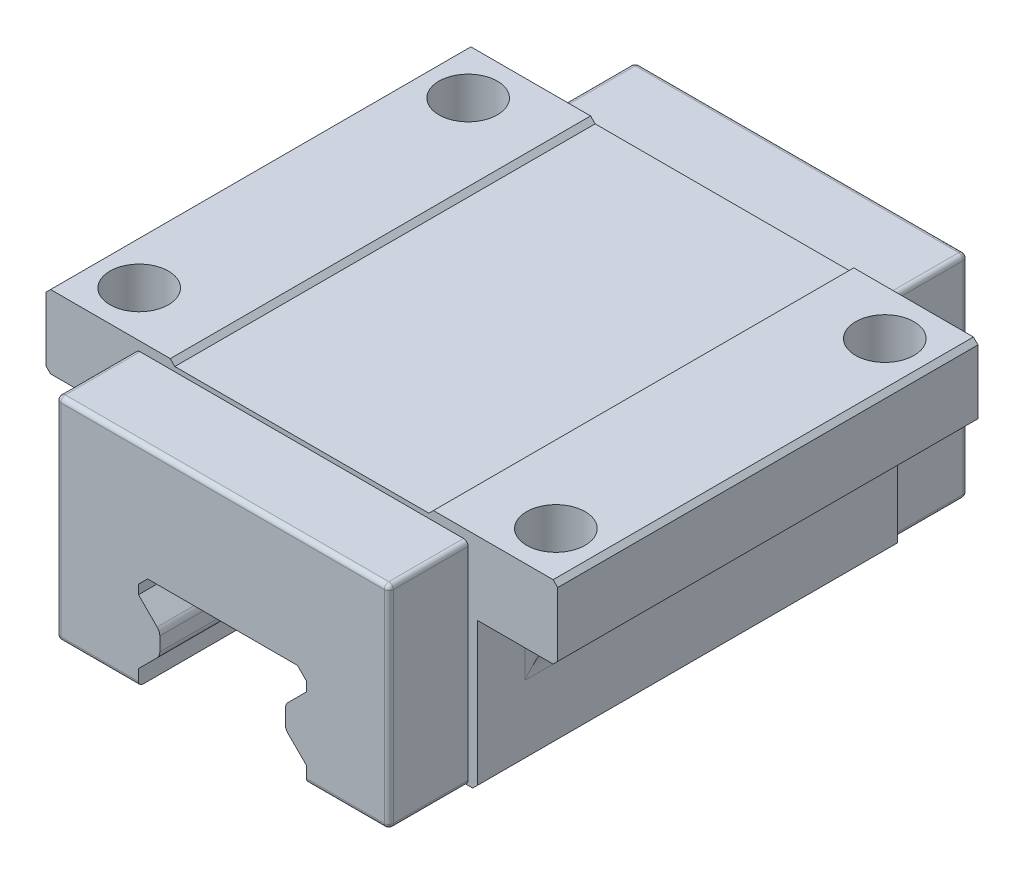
SolidWorks part; units mm, degrees
ref_plane "Front Plane" through (0, 0, 0) normal (0, 0, 1) x (1, 0, 0)
ref_plane "Top Plane" through (0, 0, 0) normal (0, 1, 0) x (1, 0, 0)
ref_plane "Right Plane" through (0, 0, 0) normal (1, 0, 0) x (0, 0, -1)
sketch "Sketch1" plane through (0, 0, 0) normal (0, 0, 1) x (1, 0, 0)
  line L1 (-24, 5.8) -> (24, 5.8)
  line L2 (-24, 5.8) -> (-24, 36)
  line L3 (-24, 36) -> (24, 36)
  line L4 (24, 5.8) -> (24, 36)
  line L5 (-24, 5.8) -> (24, 36) construction
  line L6 (-24, 36) -> (24, 5.8) construction
  point P0 (0, 20.9)
  dimension "D1" = 36
  dimension "D2" = 5.8
  dimension "D3" = 48
extrude "Boss-Extrude1" add sketch "Sketch1" along normal mid plane 57.5
sketch "Sketch2" plane through (0, 0, 0) normal (0, 0, 1) x (1, 0, 0)
  line L0 (-24, 5.8) -> (24, 5.8) construction
  line L1 (-22.75, 5.8) -> (22.75, 5.8)
  line L2 (-22.75, 5.8) -> (-22.75, 34.75)
  line L3 (-22.75, 34.75) -> (22.75, 34.75)
  line L4 (22.75, 5.8) -> (22.75, 34.75)
  line L5 (-22.75, 34.75) -> (-24, 34.75) construction
  line L6 (-24, 36) -> (-24, 5.8) construction
  line L7 (22.75, 34.75) -> (22.75, 36) construction
  line L8 (24, 36) -> (-24, 36) construction
  line L9 (22.75, 34.75) -> (24, 34.75) construction
  line L10 (24, 5.8) -> (24, 36) construction
  point P9 (0, 34.75)
  dimension "D1" = 1.25
extrude "Boss-Extrude2" add sketch "Sketch2" along normal mid plane 79.2
sketch "Sketch3" plane through (0, 0, 39.6) normal (0, 0, 1) x (1, 0, 0)
  line L1 (-11.5, 19.2) -> (11.5, 19.2)
  line L2 (-11.5, 19.2) -> (-11.5, 0)
  line L3 (-11.5, 0) -> (11.5, 0)
  line L4 (11.5, 19.2) -> (11.5, 0)
  line L5 (-11.5, 19.2) -> (11.5, 0) construction
  line L6 (-11.5, 0) -> (11.5, 19.2) construction
  point P0 (0, 9.6)
  dimension "D1" = 23
  dimension "D2" = 19.2
extrude "Cut-Extrude1" cut sketch "Sketch3" against normal through all
sketch "Sketch4" plane through (0, 0, 39.6) normal (0, 0, 1) x (1, 0, 0)
  line L0 (-11.5, 16.7) -> (-11.5, 7.95)
  line L1 (-11.5, 19.2) -> (-11.5, 5.8) construction
  line L2 (-11.5, 7.95) -> (-8.5833, 10.8667)
  line L3 (-8.5833, 10.8667) -> (-8.5833, 13.7833)
  line L4 (-8.5833, 13.7833) -> (-11.5, 16.7)
  line L5 (11.5, 19.2) -> (-11.5, 19.2) construction
  line L6 (-8.5833, 13.7833) -> (-11.5, 13.7833) construction
  line L7 (-8.5833, 10.8667) -> (-11.5, 10.8667) construction
  line L8 (-10.0417, 13.7833) -> (-10.0417, 10.8667) construction
  line L9 (0, 0) -> (0, 19.2) construction
  line L10 (10.0417, 13.7833) -> (10.0417, 10.8667) construction
  line L11 (8.5833, 10.8667) -> (11.5, 10.8667) construction
  line L12 (8.5833, 13.7833) -> (11.5, 13.7833) construction
  line L13 (8.5833, 13.7833) -> (11.5, 16.7)
  line L14 (8.5833, 10.8667) -> (8.5833, 13.7833)
  line L15 (11.5, 7.95) -> (8.5833, 10.8667)
  line L16 (11.5, 16.7) -> (11.5, 7.95)
extrude "Boss-Extrude3" add sketch "Sketch4" against normal up to surface (79.2 mm away)
chamfer "Chamfer1" distance 1.25 angle 45 2 edges at (11.5, 19.2, 0) (-11.5, 19.2, 0)
fillet "Fillet1" radius 1.25 4 edges at (8.5833, 10.8667, 0) (8.5833, 13.7833, 0) (-8.5833, 10.8667, 0) (-8.5833, 13.7833, 0)
sketch "Sketch5" plane through (0, 0, 28.75) normal (0, 0, 1) x (1, 0, 0)
  line L0 (24, 36) -> (-24, 36) construction
  line L1 (-18, 36) -> (18, 36)
  line L2 (-18, 36) -> (-18, 35.375)
  line L3 (-18, 35.375) -> (18, 35.375)
  line L4 (18, 36) -> (18, 35.375)
  point P6 (0, 35.375)
  dimension "D1" = 36
  dimension "D2" = 0.625
extrude "Cut-Extrude2" cut sketch "Sketch5" against normal through all
chamfer "Chamfer2" distance 0.625 angle 45 6 edges at (24, 36, 0) (24, 5.8, 0) (-24, 5.8, 0) (-24, 36, 0) (18, 35.375, 0) (-18, 35.375, 0)
fillet "Fillet2" radius 0.625 18 edges at (-22.75, 5.8, -34.175) (17.125, 5.8, 39.6) (17.125, 5.8, -39.6) (-22.75, 5.8, 34.175) (-17.125, 5.8, -39.6) (-17.125, 5.8, 39.6) (22.75, 5.8, 34.175) (-22.75, 20.275, 39.6) (-22.75, 20.275, -39.6) (-22.75, 34.75, 34.175) (22.75, 34.75, 34.175) (22.75, 20.275, 39.6) (22.75, 20.275, -39.6) (0, 34.75, 39.6) (0, 34.75, -39.6) (22.75, 5.8, -34.175) (22.75, 34.75, -34.175) (-22.75, 34.75, -34.175)
sketch "Sketch7" plane through (0, 0, 0) normal (0, 0, 1) x (1, 0, 0)
  line L0 (-23.375, 36) -> (-35, 36)
  line L1 (-35, 36) -> (-35, 26)
  line L2 (-23.375, 36) -> (-23.375, 15.625)
  line L3 (-24, 35.375) -> (-24, 6.425) construction
  line L4 (-24, 15.625) -> (-23.375, 15.625)
  line L5 (-35, 26) -> (-34.375, 26)
  line L6 (0, 0) -> (0, 35.375) construction
  line L7 (-17.375, 35.375) -> (17.375, 35.375) construction
  line L8 (35, 26) -> (34.375, 26)
  line L9 (24, 15.625) -> (23.375, 15.625)
  line L10 (23.375, 36) -> (23.375, 15.625)
  line L11 (35, 36) -> (35, 26)
  line L12 (23.375, 36) -> (35, 36)
  arc A1 (-34.375, 26) -> (-24, 15.625) centre (-34.375, 15.625) cw
  arc A2 (34.375, 26) -> (24, 15.625) centre (34.375, 15.625) ccw
  point P22 (-34.6875, 26)
  dimension "D1" = 70
  dimension "D2" = 10
  dimension "D3" = 0.625
extrude "Boss-Extrude4" add sketch "Sketch7" along normal mid plane 32.5
sketch "Sketch8" plane through (0, 0, 0) normal (0, 0, 1) x (1, 0, 0)
  line L0 (-35, 26) -> (-35, 36)
  line L9 (35, 26) -> (35, 36)
  line L10 (35, 26) -> (23.375, 26)
  line L11 (35, 36) -> (23.375, 36)
  line L13 (23.375, 36) -> (23.375, 26)
  line L14 (-35, 26) -> (-22.75, 26)
  line L15 (-35, 36) -> (-22.75, 36)
  line L16 (-22.75, 26) -> (-22.75, 36)
  line L17 (-22.75, 34.125) -> (-22.75, 6.425) construction
extrude "Boss-Extrude5" add sketch "Sketch8" along normal mid plane 57.5
chamfer "Chamfer3" distance 0.625 angle 45 4 edges at (-35, 26, 0) (-35, 36, 0) (35, 26, 0) (35, 36, 0)
fillet "Fillet3" radius 6 4 edges at (-24, 20.8125, 16.25) (-24, 20.8125, -16.25) (24, 20.8125, -16.25) (24, 20.8125, 16.25)
sketch "Sketch6" plane through (0, 36, 0) normal (0, 1, 0) x (1, 0, 0)
  line L1 (0, 0) -> (28.5, -22.5) construction
  line L3 (0, 0) -> (-28.5, -22.5) construction
  circle A1 centre (-28.5, -22.5) radius 4
  circle A2 centre (28.5, -22.5) radius 4
  dimension "D1" = 8
  dimension "D2" = 57
  dimension "D3" = 22.5
extrude "Cut-Extrude3" cut sketch "Sketch6" against normal blind 10
mirror "Mirror1" about plane through (0, 0, 0) normal (0, 0, 1) of "Cut-Extrude3"
equation "\"D2@Sketch4\"=\"D1@Sketch4\"*3.5"
